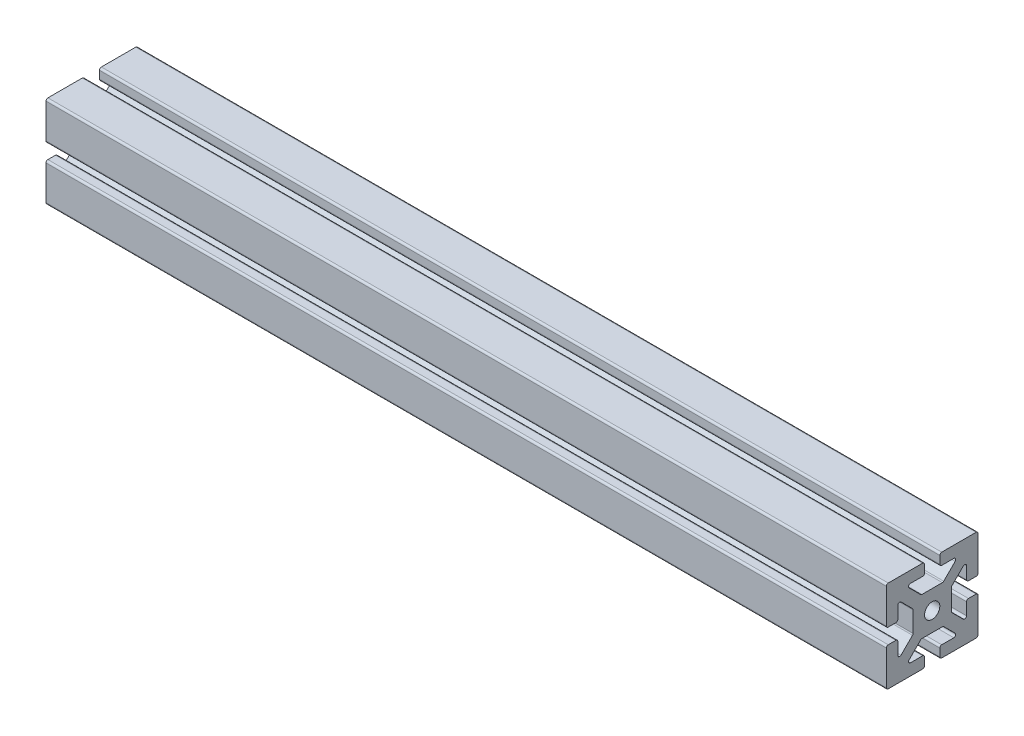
SolidWorks part; units mm, degrees
ref_plane "Front Plane" through (0, 0, 0) normal (0, 0, 1) x (1, 0, 0)
ref_plane "Top Plane" through (0, 0, 0) normal (0, 1, 0) x (1, 0, 0)
ref_plane "Right Plane" through (0, 0, 0) normal (1, 0, 0) x (0, 0, -1)
sketch "Sketch1" plane through (0, 0, 0) normal (1, 0, 0) x (0, 0, -1)
  line L4 (2.5732, 1.5126) -> (4.0732, 3.0126)
  line L5 (4.5, 2.8358) -> (4.5, 1.25)
  line L6 (4.75, 1) -> (5.75, 1)
  line L7 (6, 1.25) -> (6, 5.75)
  line L8 (5.75, 6) -> (1.25, 6)
  line L9 (1, 5.75) -> (1, 4.75)
  line L10 (1.25, 4.5) -> (2.8358, 4.5)
  line L11 (3.0126, 4.0732) -> (1.5126, 2.5732)
  line L16 (1.5126, -2.5732) -> (3.0126, -4.0732)
  line L17 (2.8358, -4.5) -> (1.25, -4.5)
  line L18 (1, -4.75) -> (1, -5.75)
  line L19 (1.25, -6) -> (5.75, -6)
  line L20 (6, -5.75) -> (6, -1.25)
  line L21 (5.75, -1) -> (4.75, -1)
  line L22 (4.5, -1.25) -> (4.5, -2.8358)
  line L23 (4.0732, -3.0126) -> (2.5732, -1.5126)
  line L26 (-2.5732, -1.5126) -> (-4.0732, -3.0126)
  line L27 (-4.5, -2.8358) -> (-4.5, -1.25)
  line L28 (-4.75, -1) -> (-5.75, -1)
  line L29 (-6, -1.25) -> (-6, -5.75)
  line L30 (-5.75, -6) -> (-1.25, -6)
  line L31 (-1, -5.75) -> (-1, -4.75)
  line L32 (-1.25, -4.5) -> (-2.8358, -4.5)
  line L33 (-3.0126, -4.0732) -> (-1.5126, -2.5732)
  line L36 (-1.5126, 2.5732) -> (-3.0126, 4.0732)
  line L37 (-2.8358, 4.5) -> (-1.25, 4.5)
  line L38 (-1, 4.75) -> (-1, 5.75)
  line L39 (-1.25, 6) -> (-5.75, 6)
  line L40 (-6, 5.75) -> (-6, 1.25)
  line L41 (-5.75, 1) -> (-4.75, 1)
  line L42 (-4.5, 1.25) -> (-4.5, 2.8358)
  line L43 (-4.0732, 3.0126) -> (-2.5732, 1.5126)
  line L47 (-2.5, 1.3358) -> (-2.5, -1.3358)
  line L48 (-1.3358, -2.5) -> (1.3358, -2.5)
  line L49 (2.5, 1.3358) -> (2.5, -1.3358)
  line L50 (1.3358, 2.5) -> (-1.3358, 2.5)
  circle A1 centre (0, 0) radius 1
  arc A2 (5.75, 6) -> (6, 5.75) centre (5.75, 5.75) cw
  arc A3 (5.75, 1) -> (6, 1.25) centre (5.75, 1.25) ccw
  arc A4 (4.5, 1.25) -> (4.75, 1) centre (4.75, 1.25) ccw
  arc A5 (4.0732, 3.0126) -> (4.5, 2.8358) centre (4.25, 2.8358) cw
  arc A6 (2.5, 1.3358) -> (2.5732, 1.5126) centre (2.75, 1.3358) cw
  arc A7 (1.3358, 2.5) -> (1.5126, 2.5732) centre (1.3358, 2.75) ccw
  arc A8 (3.0126, 4.0732) -> (2.8358, 4.5) centre (2.8358, 4.25) ccw
  arc A9 (1.25, 4.5) -> (1, 4.75) centre (1.25, 4.75) cw
  arc A10 (1, 5.75) -> (1.25, 6) centre (1.25, 5.75) cw
  arc A11 (2.5, -1.3358) -> (2.5732, -1.5126) centre (2.75, -1.3358) ccw
  arc A12 (4.0732, -3.0126) -> (4.5, -2.8358) centre (4.25, -2.8358) ccw
  arc A13 (4.5, -1.25) -> (4.75, -1) centre (4.75, -1.25) cw
  arc A14 (5.75, -1) -> (6, -1.25) centre (5.75, -1.25) cw
  arc A15 (6, -5.75) -> (5.75, -6) centre (5.75, -5.75) cw
  arc A16 (1.25, -6) -> (1, -5.75) centre (1.25, -5.75) cw
  arc A17 (1, -4.75) -> (1.25, -4.5) centre (1.25, -4.75) cw
  arc A18 (2.8358, -4.5) -> (3.0126, -4.0732) centre (2.8358, -4.25) ccw
  arc A19 (1.5126, -2.5732) -> (1.3358, -2.5) centre (1.3358, -2.75) ccw
  arc A20 (-1.3358, -2.5) -> (-1.5126, -2.5732) centre (-1.3358, -2.75) ccw
  arc A21 (-3.0126, -4.0732) -> (-2.8358, -4.5) centre (-2.8358, -4.25) ccw
  arc A22 (-1.25, -4.5) -> (-1, -4.75) centre (-1.25, -4.75) cw
  arc A23 (-1, -5.75) -> (-1.25, -6) centre (-1.25, -5.75) cw
  arc A24 (-5.75, -6) -> (-6, -5.75) centre (-5.75, -5.75) cw
  arc A25 (-6, -1.25) -> (-5.75, -1) centre (-5.75, -1.25) cw
  arc A26 (-4.75, -1) -> (-4.5, -1.25) centre (-4.75, -1.25) cw
  arc A27 (-4.5, -2.8358) -> (-4.0732, -3.0126) centre (-4.25, -2.8358) ccw
  arc A28 (-2.5732, -1.5126) -> (-2.5, -1.3358) centre (-2.75, -1.3358) ccw
  arc A29 (-2.5, 1.3358) -> (-2.5732, 1.5126) centre (-2.75, 1.3358) ccw
  arc A30 (-4.0732, 3.0126) -> (-4.5, 2.8358) centre (-4.25, 2.8358) ccw
  arc A31 (-4.75, 1) -> (-4.5, 1.25) centre (-4.75, 1.25) ccw
  arc A32 (-5.75, 1) -> (-6, 1.25) centre (-5.75, 1.25) cw
  arc A33 (-6, 5.75) -> (-5.75, 6) centre (-5.75, 5.75) cw
  arc A34 (-1.25, 6) -> (-1, 5.75) centre (-1.25, 5.75) cw
  arc A35 (-1, 4.75) -> (-1.25, 4.5) centre (-1.25, 4.75) cw
  arc A36 (-2.8358, 4.5) -> (-3.0126, 4.0732) centre (-2.8358, 4.25) ccw
  arc A37 (-1.5126, 2.5732) -> (-1.3358, 2.5) centre (-1.3358, 2.75) ccw
  point P6 (0, 0)
  point P12 (0, 0)
  point P17 (0, 0)
  point P18 (0, 0)
  point P19 (0, 0)
  point P29 (0, 0)
  point P30 (-0.1441, -0.1441)
  point P40 (0, 0)
  point P41 (0, 0)
  point P51 (0, 0)
  point P53 (0, 0)
extrude "Boss-Extrude1" add sketch "Sketch1" against normal blind 110
equation "\"A\"= 1.5"
equation "\"B\"= 2"
equation "\"C\"= 110"
equation "\"D1@Sketch1\"=\"A\""
equation "\"D2@Sketch1\"=\"B\""
equation "\"D4@Sketch1\"=\"B\""
equation "\"D7@Sketch1\"=\"A\""
equation "\"D10@Sketch1\"=(\"B\"/2)+\"A\""
equation "\"D11@Sketch1\"=(\"B\"/2)+\"A\""
equation "\"D3@Sketch1\"=\"B\""
equation "\"D1@Boss-Extrude1\"=\"C\""
